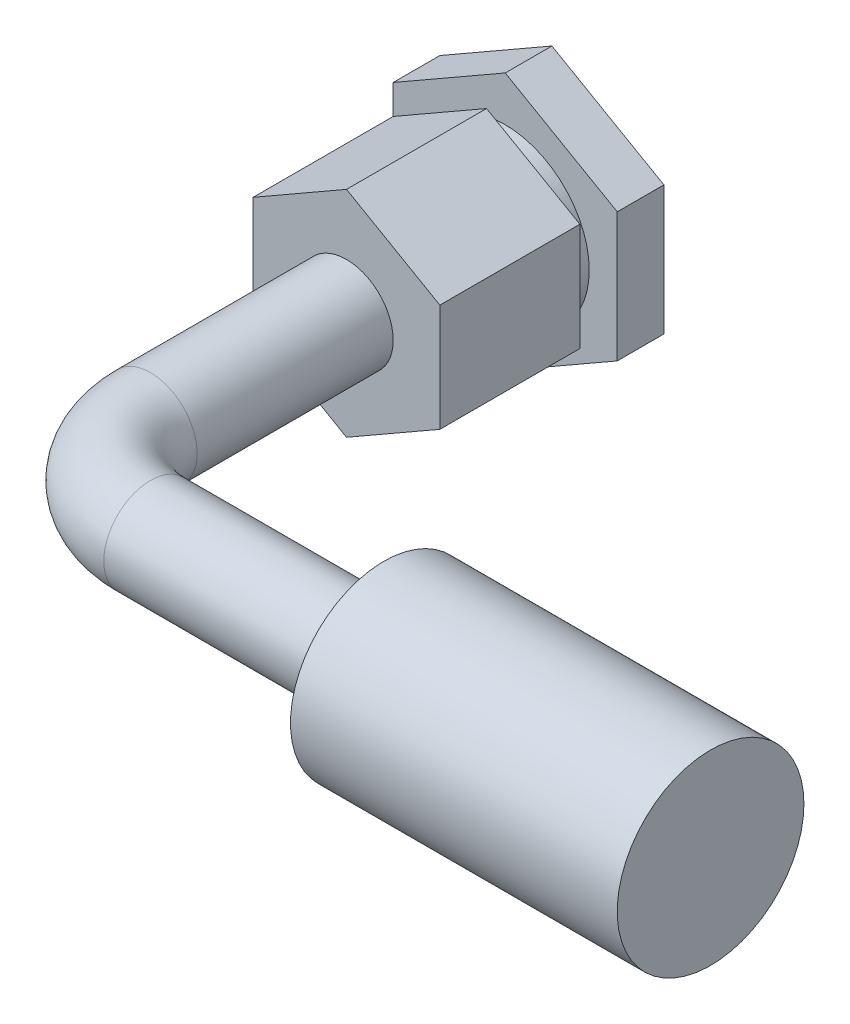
SolidWorks part; units mm, degrees
ref_plane "Plan de face" through (0, 0, 0) normal (0, 0, 1) x (1, 0, 0)
ref_plane "Plan de dessus" through (0, 0, 0) normal (0, 1, 0) x (1, 0, 0)
ref_plane "Plan de droite" through (0, 0, 0) normal (1, 0, 0) x (0, 0, -1)
sketch "Esquisse1" plane through (0, 0, 0) normal (0, 0, 1) x (1, 0, 0)
  line L0 (0, 0) -> (0, 43.8476) construction
  line L1 (0, 0) -> (39.2372, 0) construction
  line L2 (0, 13.8) -> (12, 6.9169)
  line L3 (12, 6.9169) -> (12, -6.9169)
  line L4 (0, -13.8) -> (12, -6.9169)
  line L5 (0, -13.8) -> (-12, -6.9169)
  line L6 (-12, 6.9169) -> (-12, -6.9169)
  line L7 (0, 13.8) -> (-12, 6.9169)
  circle A0 centre (0, 0) radius 8
  point P8 (12, 0)
  point P11 (-12, 0)
  dimension "D3" = 16
  dimension "D1" = 24
  dimension "D2" = 27.6
extrude "Extrusion1" add sketch "Esquisse1" along normal blind 5
sketch "Esquisse2" plane through (0, 0, 0) normal (0, 0, 1) x (1, 0, 0)
  circle A0 centre (0, 0) radius 9
  dimension "D1" = 18
extrude "Extrusion2" add sketch "Esquisse2" along normal blind 9 from offset 2
sketch "Esquisse3" plane through (0, 0, 7) normal (0, 0, 1) x (1, 0, 0)
  line L0 (0, 0) -> (0, 20.2617) construction
  line L1 (0, 0) -> (16.3785, 0) construction
  line L2 (0, 11.5) -> (10, 5.7641)
  line L3 (10, 5.7641) -> (10, -5.7641)
  line L4 (0, -11.5) -> (10, -5.7641)
  line L5 (0, -11.5) -> (-10, -5.7641)
  line L6 (-10, 5.7641) -> (-10, -5.7641)
  line L7 (0, 11.5) -> (-10, 5.7641)
  point P8 (10, 0)
  point P11 (-10, 0)
  dimension "D1" = 20
  dimension "D2" = 23
extrude "Extrusion3" add sketch "Esquisse3" along normal blind 15
sketch "Esquisse4" plane through (0, 0, 22) normal (0, 0, 1) x (1, 0, 0)
  circle A0 centre (0, 0) radius 5
  dimension "D1" = 10
sketch "Esquisse5" plane through (0, 0, 0) normal (0, 1, 0) x (1, 0, 0)
  line L0 (0, -22) -> (0, -43)
  line L1 (-5, -22) -> (5, -22) construction
  line L2 (10, -53) -> (35, -53)
  line L3 (9, 2) -> (-9, 2) construction
  arc A0 (0, -43) -> (10, -53) centre (10, -43) ccw
  dimension "D1" = 10
  dimension "D2" = 55
  dimension "D3" = 35
sweep "Balayage-Mince1" add profiles "Esquisse4" path "Esquisse5" parameters "D1"=1
sketch "Esquisse6" plane through (35, 0, 0) normal (1, 0, 0) x (0, 0, -1)
  circle A0 centre (-53, 0) radius 10
  dimension "D1" = 20
extrude "Extrusion4" add sketch "Esquisse6" along normal blind 35
